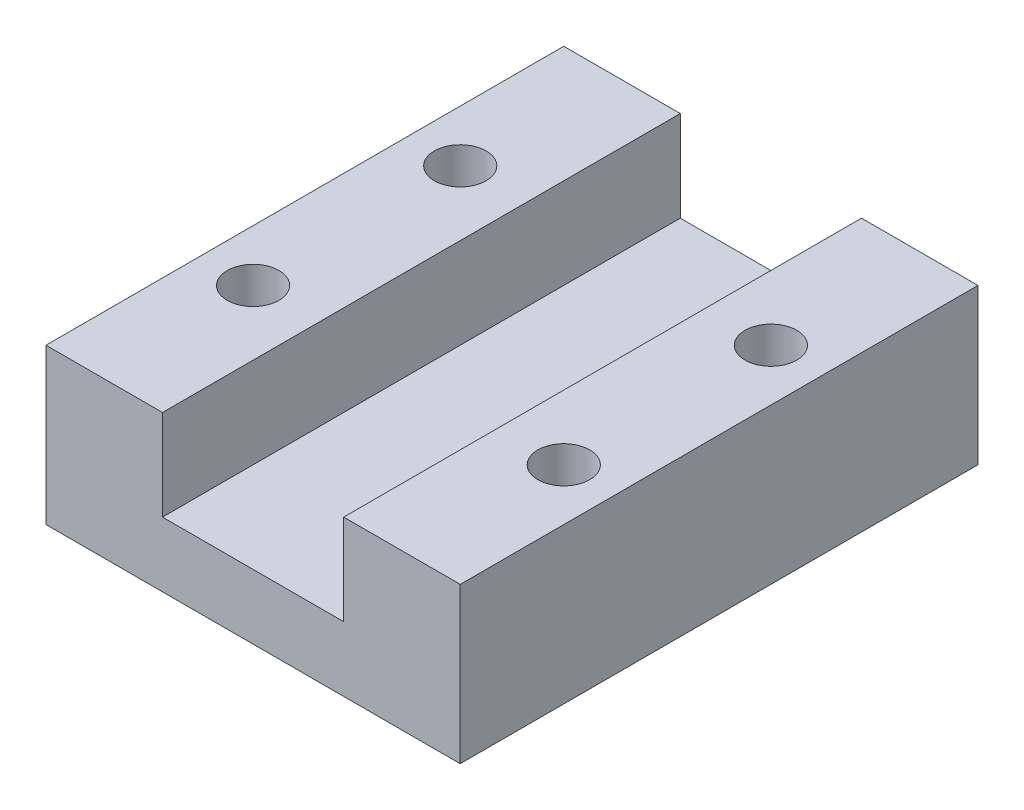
SolidWorks part; units mm, degrees
ref_plane "前视基准面" through (0, 0, 0) normal (0, 0, 1) x (1, 0, 0)
ref_plane "上视基准面" through (0, 0, 0) normal (0, 1, 0) x (1, 0, 0)
ref_plane "右视基准面" through (0, 0, 0) normal (1, 0, 0) x (0, 0, -1)
other "Configuration Table"
sketch "草图1" plane through (0, 0, 0) normal (0, 1, 0) x (1, 0, 0)
  line L1 (-8, -10) -> (8, -10)
  line L2 (-8, -10) -> (-8, 10)
  line L3 (-8, 10) -> (8, 10)
  line L4 (8, -10) -> (8, 10)
  line L5 (-8, -10) -> (8, 10) construction
  line L6 (-8, 10) -> (8, -10) construction
  point P0 (0, 0)
  dimension "D1" = 16
  dimension "D2" = 20
extrude "凸台-拉伸1" add sketch "草图1" along normal blind 6
sketch "草图3" plane through (0, 0, 10) normal (0, 0, 1) x (1, 0, 0)
  line L0 (-8, 6) -> (8, 6) construction
  line L1 (-3.5, 9.5) -> (3.5, 9.5)
  line L2 (-3.5, 9.5) -> (-3.5, 2.5)
  line L3 (-3.5, 2.5) -> (3.5, 2.5)
  line L4 (3.5, 9.5) -> (3.5, 2.5)
  line L5 (-3.5, 9.5) -> (3.5, 2.5) construction
  line L6 (-3.5, 2.5) -> (3.5, 9.5) construction
  point P0 (0, 6)
  dimension "D1" = 7
  dimension "D2" = 7
extrude "切除-拉伸1" cut sketch "草图3" against normal blind 40
sketch "草图4" plane through (0, 0, 0) normal (0, -1, 0) x (1, 0, 0)
  line L1 (-6, -4) -> (6, -4)
  line L2 (-6, -4) -> (-6, 4)
  line L3 (-6, 4) -> (6, 4)
  line L4 (6, -4) -> (6, 4)
  line L5 (-6, -4) -> (6, 4) construction
  line L6 (-6, 4) -> (6, -4) construction
  point P0 (0, 0)
  dimension "D1" = 12
  dimension "D2" = 8
hole_wizard "Ø2.0mm 暗销孔1" positions "草图4" profile "草图5" hole size "Ø2.0" standard "GB"
sketch "草图5" plane through (6, 0, -4) normal (1, 0, 0) x (0, 0, -1)
  line L0 (0, 0) -> (0, 6)
  line L1 (0, 6) -> (1, 6)
  line L2 (1, 6) -> (1, 0)
  line L5 (1, 0) -> (0, 0)
  line L11 (0, -6.35) -> (0, 107.95) construction
  dimension "通孔孔直径" = 2
  dimension "通孔孔深度" = 6
